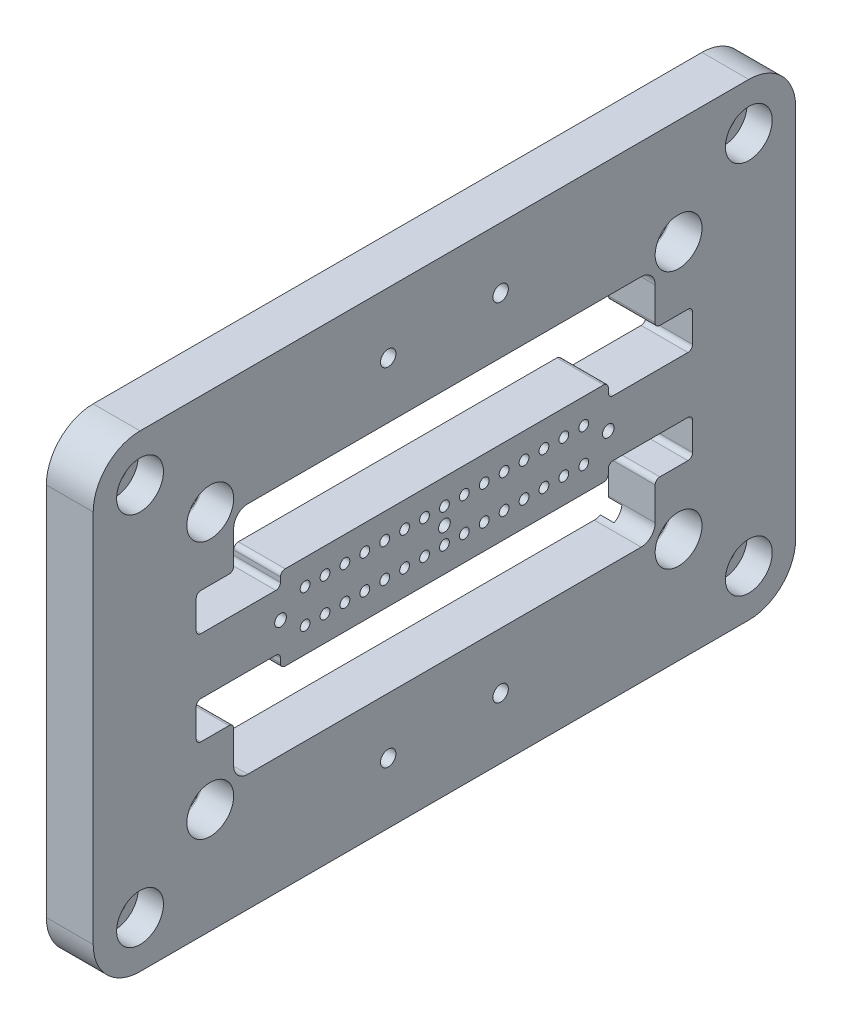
SolidWorks part; units mm, degrees
ref_plane "前视基准面" through (0, 0, 0) normal (0, 0, 1) x (1, 0, 0)
ref_plane "上视基准面" through (0, 0, 0) normal (0, 1, 0) x (1, 0, 0)
ref_plane "右视基准面" through (0, 0, 0) normal (1, 0, 0) x (0, 0, -1)
sketch "草图1" plane through (0, 0, 0) normal (1, 0, 0) x (0, 0, -1)
  line L1 (-65, 50) -> (65, 50)
  line L2 (-75, 40) -> (-75, -40)
  line L3 (-65, -50) -> (65, -50)
  line L4 (75, 40) -> (75, -40)
  line L5 (-75, 50) -> (75, -50) construction
  line L6 (-75, -50) -> (75, 50) construction
  arc A0 (65, 50) -> (75, 40) centre (65, 40) cw
  arc A1 (-75, -40) -> (-65, -50) centre (-65, -40) ccw
  arc A2 (-65, 50) -> (-75, 40) centre (-65, 40) ccw
  arc A3 (65, -50) -> (75, -40) centre (65, -40) ccw
  point P0 (0, 0)
  dimension "D3" = 10
  dimension "D1" = 150
  dimension "D2" = 100
extrude "凸台-拉伸1" add sketch "草图1" along normal blind 10
hole_wizard "Ø12.0mm 暗销孔1" positions "草图2" profile "草图3" hole size "Ø12.0" standard "ISO"
sketch "草图2" plane through (0, 0, 0) normal (-1, 0, 0) x (0, 0, 1)
  line L0 (0, 0) -> (97.962, 0) construction
  line L2 (0, 0) -> (0, 52.6043) construction
  point P0 (50, 27.5)
  point P12 (50, -27.5)
  point P13 (-50, -27.5)
  point P14 (-50, 27.5)
  dimension "D1" = 27.5
  dimension "D2" = 50
  dimension "D3" = 55
  dimension "D4" = 100
sketch "草图3" plane through (0, 27.5, 50) normal (0, 1, 0) x (0, 0, 1)
  line L0 (0, 0) -> (0, 2.9)
  line L1 (0, 2.9) -> (7.25, 2.9)
  line L2 (7.25, 2.9) -> (7.25, 0)
  line L5 (7.25, 0) -> (0, 0)
  line L10 (0, 2.9) -> (-7.25, 2.9) construction
  line L11 (0, -6.35) -> (0, 107.95) construction
  dimension "孔直径" = 14.5
  dimension "孔深度" = 2.9
  dimension "导头角度" = 180
hole_wizard "Ø10.0mm 暗销孔1" positions "草图4" profile "草图5" hole size "Ø10.0" standard "ISO"
sketch "草图4" plane through (10, 0, 0) normal (1, 0, 0) x (0, 0, -1)
  point P29 (50, -27.5)
  point P32 (50, 27.5)
  point P35 (-50, 27.5)
  point P38 (-50, -27.5)
sketch "草图5" plane through (10, -27.5, -50) normal (0, 1, 0) x (0, 0, -1)
  line L0 (0, 0) -> (0, 18.0043)
  line L1 (0, 18.0043) -> (5, 15)
  line L2 (5, 15) -> (5, 0)
  line L5 (5, 0) -> (0, 0)
  line L10 (0, 18.0043) -> (-5, 15) construction
  line L11 (0, -6.35) -> (0, 107.95) construction
  dimension "孔直径" = 10
  dimension "孔深度" = 15
  dimension "导头角度" = 118
sketch "草图13" plane through (0, 0, 0) normal (-1, 0, 0) x (0, 0, 1)
  line L0 (0, 0) -> (93.0894, 0) construction
  line L1 (0, 0) -> (0, 31.3557) construction
  circle A2 centre (65, 40) radius 4
  circle A10 centre (65, -40) radius 4
  circle A11 centre (-65, -40) radius 4
  circle A12 centre (-65, 40) radius 4
  dimension "D1" = 8
  dimension "D2" = 65
  dimension "D3" = 40
extrude "切除-拉伸2" cut sketch "草图13" against normal blind 2.6
hole_wizard "M5 六角凹头螺钉的柱形沉头孔1" positions "草图14" profile "草图15" counterbore size "M5" standard "ISO"
sketch "草图14" plane through (10, 0, 0) normal (1, 0, 0) x (0, 0, -1)
  point P0 (-65, 40)
  point P3 (65, 40)
  point P6 (65, -40)
  point P9 (-65, -40)
sketch "草图15" plane through (10, 40, 65) normal (0, 1, 0) x (0, 0, -1)
  line L0 (0, 0) -> (0, 10)
  line L1 (0, 10) -> (2.75, 10)
  line L3 (2.75, 10) -> (2.75, 5.4)
  line L4 (2.75, 5.4) -> (5, 5.4)
  line L5 (5, 5.4) -> (5, 0)
  line L7 (5, 0) -> (0, 0)
  line L11 (0, -6.35) -> (0, 107.95) construction
  dimension "通孔孔直径" = 5.5
  dimension "通孔孔深度" = 10
  dimension "柱形沉头孔直径" = 10
  dimension "柱形沉头孔深度" = 5.4
hole_wizard "M4 螺纹孔1" positions "草图16" profile "草图17" tap size "M4" standard "ISO"
sketch "草图16" plane through (0, 0, 0) normal (-1, 0, 0) x (0, 0, 1)
  line L0 (50, 27.5) -> (50, 18) construction
  line L1 (0, 0) -> (112.3189, 0) construction
  line L3 (0, 0) -> (0, 24.2303) construction
  line L4 (65, -27.5) -> (65, -18) construction
  point P2 (50, 18)
  point P15 (65, -18)
  point P21 (-65, -18)
  point P22 (-50, 18)
  dimension "D1" = 9.5
  dimension "D2" = 9.5
sketch "草图17" plane through (0, 18, -50) normal (0, 1, 0) x (0, 0, 1)
  line L0 (0, 0) -> (0, 10)
  line L1 (0, 10) -> (1.65, 10)
  line L2 (1.65, 10) -> (1.65, 0)
  line L5 (1.65, 0) -> (0, 0)
  line L11 (0, -6.35) -> (0, 107.95) construction
  dimension "通孔螺纹孔钻头直径" = 3.3
  dimension "通孔螺纹孔钻头深度" = 10
sketch "草图18" plane through (0, 0, 0) normal (-1, 0, 0) x (0, 0, 1)
  line L1 (-45, 25) -> (45, 25)
  line L2 (-45, 25) -> (-45, -25)
  line L3 (-45, -25) -> (45, -25)
  line L4 (45, 25) -> (45, -25)
  line L5 (0, -25) -> (0, 25) construction
  line L6 (-45, 0) -> (45, 0) construction
  point P0 (0, 0)
  dimension "D1" = 50
  dimension "D2" = 90
extrude "切除-拉伸3" cut sketch "草图18" against normal through all
hole_wizard "M4 螺纹孔2" positions "草图26" profile "草图27" tap size "M4" standard "ISO"
sketch "草图26" plane through (0, 0, 0) normal (-1, 0, 0) x (0, 0, 1)
  line L2 (0, 0) -> (85.8672, 0) construction
  line L4 (0, 0) -> (0, -71.871) construction
  point P0 (12, -37)
  point P13 (12, 37)
  point P20 (-12, 37)
  point P21 (-12, -37)
  dimension "D1" = 74
  dimension "D2" = 24
sketch "草图27" plane through (0, -37, 12) normal (0, 1, 0) x (0, 0, 1)
  line L0 (0, 0) -> (0, 10)
  line L1 (0, 10) -> (1.65, 10)
  line L2 (1.65, 10) -> (1.65, 0)
  line L5 (1.65, 0) -> (0, 0)
  line L11 (0, -6.35) -> (0, 107.95) construction
  dimension "通孔螺纹孔钻头直径" = 3.3
  dimension "通孔螺纹孔钻头深度" = 10
hole_wizard "M3 螺纹孔3" positions "草图28" profile "草图29" tap size "M3" standard "ISO"
sketch "草图28" plane through (0, 0, 0) normal (-1, 0, 0) x (0, 0, 1)
  line L0 (-50, 27.5) -> (-50, 10.5403) construction
  line L2 (50, -27.5) -> (50, -10.747) construction
  circle A0 centre (-50, 27.5) radius 5 construction
  circle A1 centre (50, -27.5) radius 5 construction
  point P0 (-47, 18.5)
  point P3 (-53, 18.5)
  point P6 (53, -18.5)
  point P9 (47, -18.5)
  dimension "D1" = 9
  dimension "D2" = 6
  dimension "D3" = 3
  dimension "D4" = 9
sketch "草图29" plane through (0, 18.5, -47) normal (0, 1, 0) x (0, 0, 1)
  line L0 (0, 0) -> (0, 8.2511)
  line L1 (0, 8.2511) -> (1.25, 7.5)
  line L2 (1.25, 7.5) -> (1.25, 0)
  line L5 (1.25, 0) -> (0, 0)
  line L10 (0, 8.2511) -> (-1.25, 7.5) construction
  line L11 (0, -6.35) -> (0, 107.95) construction
  dimension "螺纹孔钻头直径" = 2.5
  dimension "螺纹孔钻头深度" = 7.5
  dimension "导头角度" = 118
fillet "圆角3" radius 0.5 4 edges at (2.9, 27.5, 45) (2.9, -27.5, -55) (2.9, -27.5, 45) (2.9, 27.5, -55)
sketch "草图30" plane through (10, 0, 0) normal (1, 0, 0) x (0, 0, -1)
  line L0 (45, 25) -> (45, -25) construction
  line L1 (-45, 9) -> (45, 9)
  line L2 (-45, 9) -> (-45, -9)
  line L3 (-45, -9) -> (45, -9)
  line L4 (45, 9) -> (45, -9)
  line L5 (-45, 9) -> (45, -9) construction
  line L6 (-45, -9) -> (45, 9) construction
  point P0 (0, 0)
  dimension "D1" = 18
extrude "凸台-拉伸2" add sketch "草图30" against normal up to surface (10 mm away)
hole_wizard "Ø2.1 (2.1) 直径孔1" positions "草图31" profile "草图32" hole size "Ø2.1" standard "GB"
sketch "草图31" plane through (10, 0, 0) normal (1, 0, 0) x (0, 0, -1)
  line L0 (0, 0) -> (26.7115, 0) construction
  line L3 (0, 0) -> (0, 10.9287) construction
  point P0 (0, 3.595)
  point P17 (0, -3.595)
  point P19 (4.25, 3.595)
  point P20 (4.25, -3.595)
  point P21 (8.5, 3.595)
  point P22 (8.5, -3.595)
  point P23 (12.75, 3.595)
  point P24 (12.75, -3.595)
  point P27 (12.75, 3.595)
  point P28 (12.75, -3.595)
  point P29 (17, 3.595)
  point P30 (17, -3.595)
  point P31 (21.25, 3.595)
  point P32 (21.25, -3.595)
  point P33 (21.25, 3.595)
  point P34 (21.25, -3.595)
  point P35 (25.5, 3.595)
  point P36 (25.5, -3.595)
  point P37 (29.75, 3.595)
  point P38 (29.75, -3.595)
  point P39 (-29.75, -3.595)
  point P40 (-29.75, 3.595)
  point P41 (-25.5, -3.595)
  point P42 (-25.5, 3.595)
  point P43 (-21.25, -3.595)
  point P44 (-21.25, 3.595)
  point P45 (-17, -3.595)
  point P46 (-17, 3.595)
  point P47 (-12.75, -3.595)
  point P48 (-12.75, 3.595)
  point P49 (-8.5, -3.595)
  point P50 (-8.5, 3.595)
  point P51 (-4.25, -3.595)
  point P52 (-4.25, 3.595)
  dimension "D1" = 7.19
  dimension "D2" = 4
  dimension "D3" = 3
sketch "草图32" plane through (10, 3.595, 0) normal (0, 1, 0) x (0, 0, -1)
  line L0 (0, 0) -> (0, 10)
  line L1 (0, 10) -> (1.05, 10)
  line L2 (1.05, 10) -> (1.05, 0)
  line L5 (1.05, 0) -> (0, 0)
  line L11 (0, -6.35) -> (0, 107.95) construction
  dimension "通孔孔直径" = 2.1
  dimension "通孔孔深度" = 10
sketch "草图34" plane through (0, 0, 0) normal (-1, 0, 0) x (0, 0, 1)
  circle A0 centre (-29.75, 3.595) radius 1.6
  circle A1 centre (-29.75, -3.595) radius 1.6
  dimension "D1" = 3.2
extrude "切除-拉伸5" cut sketch "草图34" against normal blind 2
hole_wizard "M3 螺纹孔4" positions "草图35" profile "草图36" tap size "M3" standard "GB"
sketch "草图35" plane through (0, 0, 0) normal (-1, 0, 0) x (0, 0, 1)
  line L0 (0, 0) -> (0, 17.5636) construction
  line L3 (0, 0) -> (-57.5869, 0) construction
  point P0 (-35, 0)
  point P2 (0, 0)
  point P19 (35, 0)
  dimension "D1" = 70
sketch "草图36" plane through (0, 0, -35) normal (0, 1, 0) x (0, 0, 1)
  line L0 (0, 0) -> (0, 10)
  line L1 (0, 10) -> (1.25, 10)
  line L2 (1.25, 10) -> (1.25, 0)
  line L5 (1.25, 0) -> (0, 0)
  line L11 (0, -6.35) -> (0, 107.95) construction
  dimension "通孔螺纹孔钻头直径" = 2.5
  dimension "通孔螺纹孔钻头深度" = 10
fillet "圆角4" radius 3 8 edges at (6.45, -25, -45) (6.45, -25, 45) (5, -9, 45) (5, -9, -45) (5, 9, -45) (5, 9, 45) (6.45, 25, 45) (6.45, 25, -45)
pattern_linear "阵列(线性)1" count 15 spacing 4.25 along (0, 0, 1) of "切除-拉伸5"
sketch "草图37" plane through (0, 0, 0) normal (-1, 0, 0) x (0, 0, 1)
  line L0 (-35, 9) -> (-35, 6)
  line L1 (-42, 9) -> (42, 9) construction
  line L2 (-35, 6) -> (-53, 6)
  line L3 (-53, 6) -> (-53, 14)
  line L4 (-53, 14) -> (-35, 14)
  line L5 (-35, 14) -> (-35, 9)
  line L6 (-45, 22) -> (-45, 12) construction
  line L7 (0, 0) -> (0, 17.0921) construction
  line L8 (0, 0) -> (-57.3469, 0) construction
  line L9 (35, 14) -> (35, 9)
  line L10 (53, 14) -> (35, 14)
  line L11 (53, 6) -> (53, 14)
  line L12 (35, 6) -> (53, 6)
  line L13 (35, 9) -> (35, 6)
  line L14 (35, -9) -> (35, -6)
  line L15 (35, -6) -> (53, -6)
  line L16 (53, -6) -> (53, -14)
  line L17 (53, -14) -> (35, -14)
  line L18 (35, -14) -> (35, -9)
  line L19 (-35, -14) -> (-35, -9)
  line L20 (-53, -14) -> (-35, -14)
  line L21 (-53, -6) -> (-53, -14)
  line L22 (-35, -6) -> (-53, -6)
  line L23 (-35, -9) -> (-35, -6)
  dimension "D1" = 3
  dimension "D2" = 8
  dimension "D3" = 8
  dimension "D4" = 35
extrude "切除-拉伸6" cut sketch "草图37" against normal blind 10
fillet "圆角5" radius 1 20 edges at (5, -9, -35) (5, -6, -35) (5, -6, -53) (5, -14, -53) (5, -14, -45) (5, -14, 45) (5, -14, 53) (5, -6, 53) (5, -6, 35) (5, -9, 35) (5, 14, 45) (5, 14, 53) (5, 6, 53) (5, 6, 35) (5, 9, 35) (5, 14, -45) (5, 14, -53) (5, 6, -53) (5, 6, -35) (5, 9, -35)
